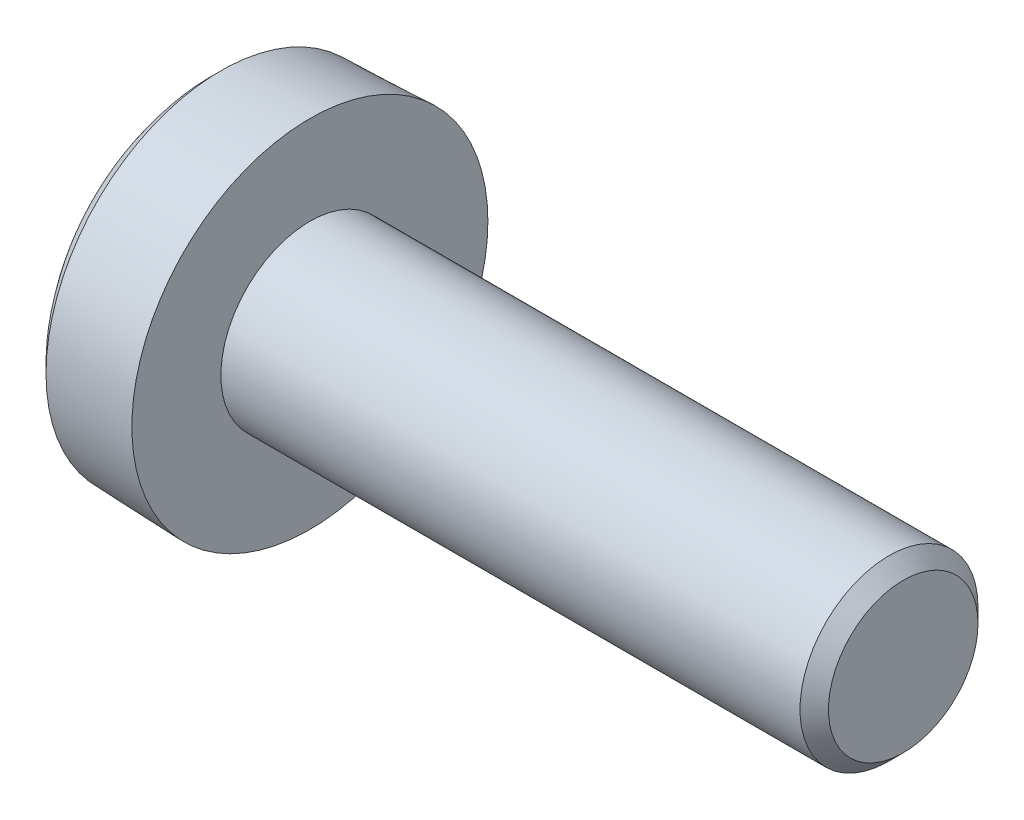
SolidWorks part; units mm, degrees
ref_plane "Plan de face" through (0, 0, 0) normal (0, 0, 1) x (1, 0, 0)
ref_plane "Plan de dessus" through (0, 0, 0) normal (0, 1, 0) x (1, 0, 0)
ref_plane "Plan de droite" through (0, 0, 0) normal (1, 0, 0) x (0, 0, -1)
sketch "Esquisse1" plane through (0, 0, 0) normal (0, 1, 0) x (1, 0, 0)
  line L0 (20, 0) -> (20, 2.52)
  line L1 (-55, 0) -> (55, 0) construction
  line L2 (20, 2.52) -> (19.52, 3)
  line L3 (19.52, 3) -> (0, 3)
  line L4 (0, 3) -> (0, 6)
  line L5 (0, 6) -> (-3, 5.8952)
  line L6 (-4.5, 0) -> (-4.5, 2.52)
  line L7 (0, -55) -> (0, 55) construction
  line L8 (27.4963, 0) -> (-4.5, 0) construction
  line L9 (-4.5, 0) -> (20, 0)
  arc A1 (-4.5, 2.52) -> (-3, 5.8952) centre (0.0474, 2.52) cw
revolve "Révolution1" add sketch "Esquisse1" angle 360 about L8
sketch "Esquisse3" plane through (0, 0, 0) normal (1, 0, 0) x (0, 0, -1)
  line L3 (0, 3) -> (-2.5981, 1.5)
  line L4 (-2.5981, 1.5) -> (-2.5981, -1.5)
  line L5 (-2.5981, -1.5) -> (0, -3)
  line L6 (0, -3) -> (2.5981, -1.5)
  line L7 (2.5981, -1.5) -> (2.5981, 1.5)
  line L8 (2.5981, 1.5) -> (0, 3)
  circle A0 centre (0, 0) radius 3 construction
  circle A1 centre (0, 0) radius 3 construction
  circle A2 centre (0, 0) radius 2.5981 construction
  circle A3 centre (0, 0) radius 2.5981 construction
  dimension "D2" = 6
extrude "Enlèv. mat.-Extru.1" cut sketch "Esquisse3" against normal through all from offset 1 contours L3 L4 L5 L6 L7 L8
sketch "Esquisse5" plane through (0, 0, 0) normal (0, 0, 1) x (1, 0, 0)
  line L0 (-4.4746, 3) -> (-3.4746, 2)
  line L1 (-3.4746, 2) -> (-3.4746, 0)
  line L2 (-4.4746, 3) -> (-5.4746, 4)
  line L3 (55, 0) -> (-55, 0) construction
  line L4 (-3.4746, 0) -> (-5.4746, 0)
  line L5 (-5.4746, 0) -> (-5.4746, 4)
  dimension "D1" = 45
  dimension "D2" = 1
  dimension "D3" = 1
revolve "Enlèvement de matière-Révolution1" cut sketch "Esquisse5" angle 360 about L4
equation "\"D3@Esquisse1\"=0.08*\"D1@Esquisse1\""
equation "\"D5@Esquisse1\"=2*\"D1@Esquisse1\""
equation "\"D6@Esquisse1\"=0.75*\"D1@Esquisse1\""
equation "\"D7@Esquisse1\"=0.5*\"D1@Esquisse1\""
